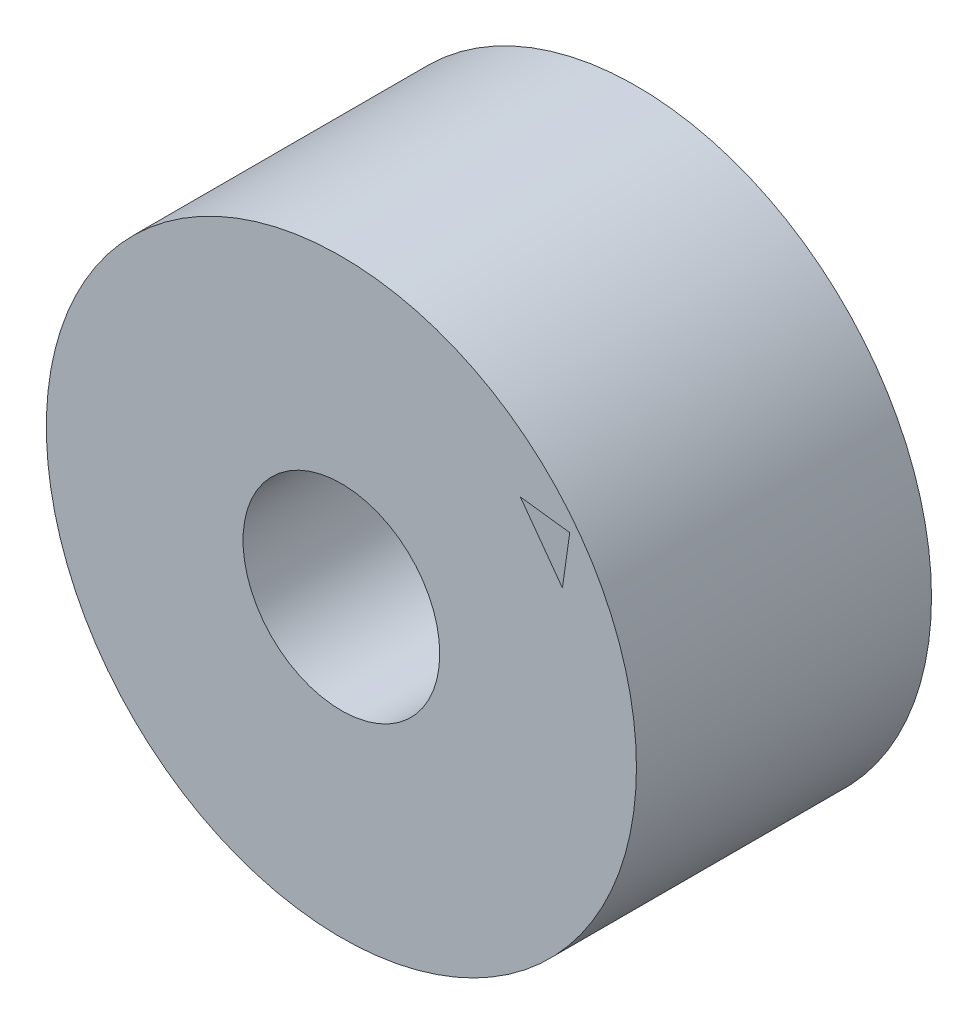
SolidWorks part; units mm, degrees
ref_plane "Plan1" through (0, 0, 0) normal (0, 0, 1) x (1, 0, 0)
ref_plane "Plan2" through (0, 0, 0) normal (0, 1, 0) x (1, 0, 0)
ref_plane "Plan3" through (0, 0, 0) normal (1, 0, 0) x (0, 0, -1)
imported_body "Importée1"
sketch "Esquisse1" plane through (0, 0, 0) normal (0, 0, -1) x (-1, 0, 0)
  line L0 (-12.0322, 8.9575) -> (0, 0) construction
  line L3 (50.1077, 91.2054) -> (-21.6273, -3.7424) construction
  line L4 (-11.6101, 8.6432) -> (-11.236, 6.0211)
  line L5 (-11.236, 6.0211) -> (-9.1003, 8.9574)
  line L6 (-9.1003, 8.9574) -> (-11.6101, 8.6432)
extrude "Enlèv. mat.-Extru.1" cut sketch "Esquisse1" against normal through all
